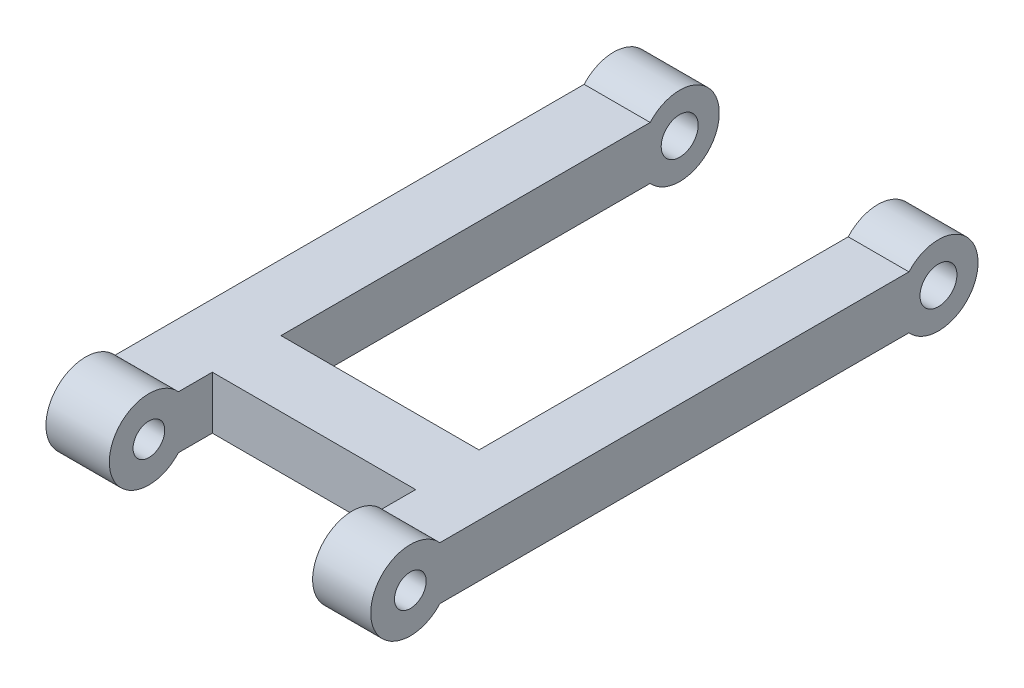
SolidWorks part; units mm, degrees
ref_plane "Front Plane" through (0, 0, 0) normal (0, 0, 1) x (1, 0, 0)
ref_plane "Top Plane" through (0, 0, 0) normal (0, 1, 0) x (1, 0, 0)
ref_plane "Right Plane" through (0, 0, 0) normal (1, 0, 0) x (0, 0, -1)
sketch "Sketch1" plane through (0, 0, 0) normal (1, 0, 0) x (0, 0, -1)
  line L1 (0, 0) -> (50.8, 0)
  line L2 (0, 0) -> (0, 5.08)
  line L3 (0, 5.08) -> (50.8, 5.08)
  line L4 (50.8, 0) -> (50.8, 5.08)
  dimension "D1" = 5.08
  dimension "D2" = 50.8
extrude "Boss-Extrude1" add sketch "Sketch1" along normal blind 31.242
sketch "Sketch2" plane through (31.242, 0, 0) normal (1, 0, 0) x (0, 0, -1)
  line L0 (0, 5.08) -> (0, 0) construction
  line L1 (50.8, 0) -> (50.8, 5.08) construction
  circle A0 centre (0, 2.54) radius 3.81
  circle A1 centre (50.8, 2.54) radius 3.81
  dimension "D1" = 7.62
  dimension "D2" = 7.62
extrude "Boss-Extrude2" add sketch "Sketch2" against normal blind 31.242
sketch "Sketch3" plane through (0, 5.08, 0) normal (0, 1, 0) x (1, 0, 0)
  line L1 (0, 47.9602) -> (0, 2.8398) construction
  line L6 (15.875, -8.3954) -> (15.875, 60.0398) construction
  line L7 (6.35, 57.9101) -> (6.35, 26.5275)
  line L10 (6.35, 57.9101) -> (25.4, 57.9101)
  line L11 (25.4, 57.9101) -> (25.4, 26.5275)
  line L19 (6.096, 6.0994) -> (25.654, 6.0994)
  line L20 (6.096, 6.0994) -> (6.096, -7.5618)
  line L21 (6.096, -7.5618) -> (25.654, -7.5618)
  line L22 (25.654, 6.0994) -> (25.654, -7.5618)
  line L23 (6.096, 6.0994) -> (25.654, -7.5618) construction
  line L24 (6.096, -7.5618) -> (25.654, 6.0994) construction
  line L26 (25.4, 26.5275) -> (25.4, 12.4494)
  line L27 (25.4, 12.4494) -> (6.35, 12.4494)
  line L28 (6.35, 12.4494) -> (6.35, 26.5275)
  point P15 (15.875, 57.9101)
  point P17 (15.875, 12.4494)
  point P22 (15.875, -0.7312)
  dimension "D1" = 6.35
  dimension "D4" = 6.35
  dimension "D5" = 19.558
extrude "Cut-Extrude1" cut sketch "Sketch3" against normal through all both and the other way through all
sketch "Sketch4" plane through (0, 0, 0) normal (-1, 0, 0) x (0, 0, 1)
  circle A0 centre (-50.8, 2.54) radius 1.778
  circle A1 centre (0, 2.54) radius 1.524
  dimension "D1" = 3.048
  dimension "D2" = 3.556
extrude "Cut-Extrude2" cut sketch "Sketch4" against normal through all
